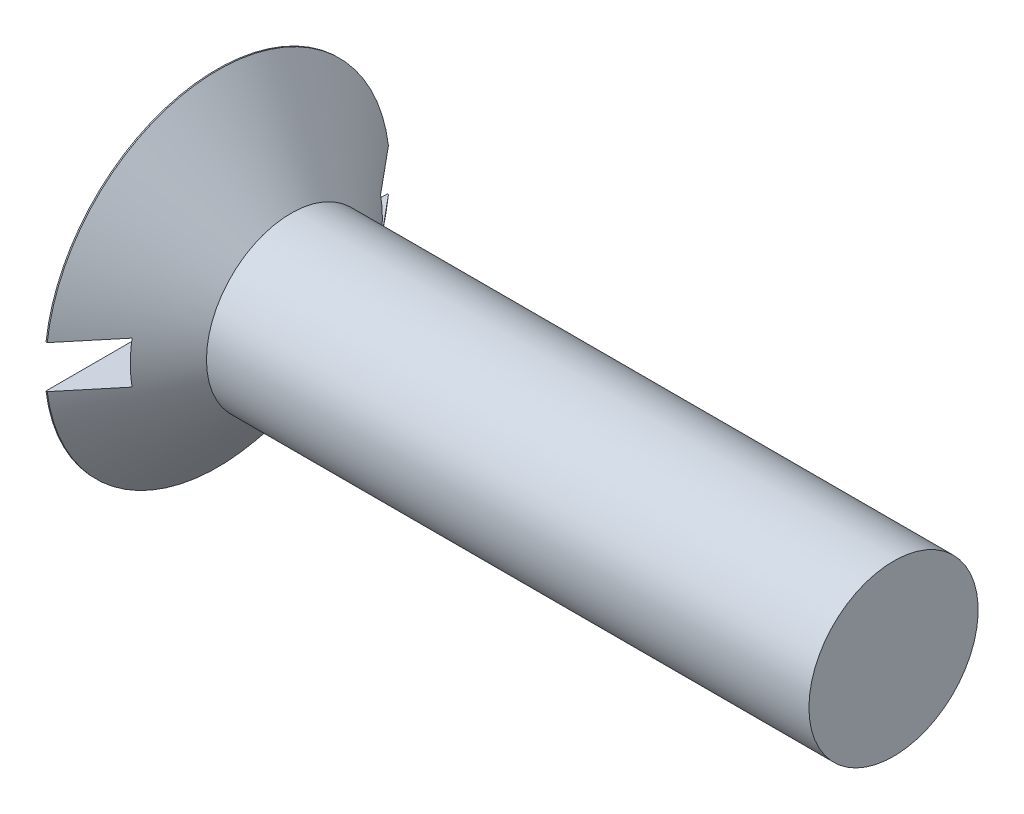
SolidWorks part; units mm, degrees
revolve "Base-Revolve" add sketch "BodySke" angle 360 about L5
sketch "BodySke" plane through (0, 0, 0) normal (0, 0, 1) x (1, 0, 0)
  line L0 (0, 0) -> (0, 9.6774)
  line L1 (0, 9.6774) -> (0.0669, 9.6774)
  line L2 (4.191, 4.7625) -> (38.1, 4.7625)
  line L3 (38.1, 4.7625) -> (38.1, 0)
  line L4 (38.1, 0) -> (0, 0)
  line L5 (-6.35, 0) -> (82.55, 0) construction
  line L6 (4.191, -4.7625) -> (38.1, -4.7625) construction
  line L7 (0.0669, -9.6774) -> (4.191, -4.7625) construction
  line L8 (0.0669, 9.6774) -> (4.191, 4.7625)
  line L9 (0, -9.6774) -> (0.0669, -9.6774) construction
  line L10 (5.7785, 6.35) -> (5.7785, -3.175) construction
  line L11 (6.35, 6.35) -> (6.35, -3.175) construction
extrude "Slot" cut sketch "Sketch2" against normal blind 2.2352
sketch "Sketch2" plane through (0, 0, 0) normal (-1, 0, 0) x (0, 0, 1)
  line L0 (-9.6774, -1.1938) -> (9.6774, -1.1938)
  line L1 (-9.6774, -1.1938) -> (-9.6774, 1.1938)
  line L2 (9.6774, 1.1938) -> (-9.6774, 1.1938)
  line L3 (9.6774, 1.1938) -> (9.6774, -1.1938)
ref_plane "Plane1" through (0, 0, 0) normal (0, 0, 1) x (1, 0, 0)
ref_plane "Plane2" through (0, 0, 0) normal (0, 1, 0) x (1, 0, 0)
ref_plane "Plane3" through (0, 0, 0) normal (1, 0, 0) x (0, 0, -1)
other "Configuration Table"
sketch "Sketch3" plane through (0, 0, 0) normal (-1, 0, 0) x (0, 0, 1)
  line L0 (-1.0922, 6.6421) -> (1.0922, 6.6421)
  line L1 (1.0922, 6.6421) -> (1.0922, -6.6421)
  line L2 (1.0922, -6.6421) -> (-1.0922, -6.6421)
  line L3 (-1.0922, -6.6421) -> (-1.0922, 6.6421)
ref_plane "Plane4" through (7.9756, 0, 0) normal (-1, 0, 0) x (0, 0, 1)
sketch "Sketch4" plane through (7.9756, 0, 0) normal (-1, 0, 0) x (0, 0, 1)
  line L0 (-0.5461, 0.5461) -> (0.5461, 0.5461)
  line L3 (0.5461, 0.5461) -> (0.5461, -0.5461)
  line L4 (0.5461, -0.5461) -> (-0.5461, -0.5461)
  line L5 (-0.5461, -0.5461) -> (-0.5461, 0.5461)
loft "Cross" cut profiles "Sketch3", "Sketch4"
pattern_circular "CirPattern1" count 2 every 90 about axis through (0, 0, 0) along (1, 0, 0) of "Cross"
sketch "ThdSchSke" plane through (0, 0, 0) normal (0, 0, 1) x (1, 0, 0)
  line L0 (6.35, -3.9624) -> (5.7898, -4.7625)
  line L1 (6.35, -3.9624) -> (6.9103, -4.7625)
  line L2 (6.9103, -4.7625) -> (6.9103, -5.9531)
  line L3 (-3.175, 0) -> (5.1513, 0) construction
  line L5 (6.9103, -5.9531) -> (5.7898, -5.9531)
  line L6 (5.7898, -5.9531) -> (5.7898, -4.7625)
  line L7 (0, 9.6774) -> (0, 1.1938) construction
revolve "ThreadSchematic" [suppressed] cut sketch "ThdSchSke" angle 360 about L3
pattern_linear "ThdSchPat" [suppressed]
equation "\"D1@Sketch3\" = \"Cross_dia@Sketch3\" / 2"
equation "\"D2@Sketch3\" = \"Cross_width@Sketch3\" / 2"
equation "\"D1@Sketch4\" = \"Cross_width@Sketch3\" *.5"
equation "\"D2@Sketch4\" = \"D1@Sketch4\""
equation "\"D4@Sketch4\" = \"D2@Sketch4\" / 2"
equation "\"D3@Sketch4\" = \"D1@Sketch4\" / 2"
equation "\"D1@Sketch2\" = \"Slot_width@Sketch2\" / 2"
equation "\"D2@Sketch2\" = \"Head_dia@BodySke\""
equation "\"D3@Sketch2\" = \"D2@Sketch2\" / 2"
equation "\"Thread_length@ThreadCosmetic\" = ((sgn( (\"Length@BodySke\" - \"Advance@BodySke\" - \"Head_ht@BodySke\" ) - \"Thread_nom@BodySke\" )-1)*( (\"Length@BodySke\" - \"Advance@BodySke\" - \"Head_ht@BodySke\" ) - \"Thread_"
equation "\"Thread_minor@ThdSchSke\" = \"Thread_minor@ThreadCosmetic\""
equation "\"Diameter@ThdSchSke\" = \"Diameter@BodySke\""
equation "\"Overcut@ThdSchSke\" = \"Diameter@BodySke\" * 1.25"
equation "\"Start@ThdSchSke\" = 0.000001 + \"Length@BodySke\" - \"Thread_length@ThreadCosmetic\"  '---Countersunk---"
equation "\"Num_threads@ThdSchPat\" = int( \"Thread_length@ThreadCosmetic\" / \"Advance@BodySke\" + 0.999 )  + 1"
equation "\"Advance@ThdSchPat\" = \"Thread_length@ThreadCosmetic\" /  (\"Num_threads@ThdSchPat\" - 1) 'relax it"
